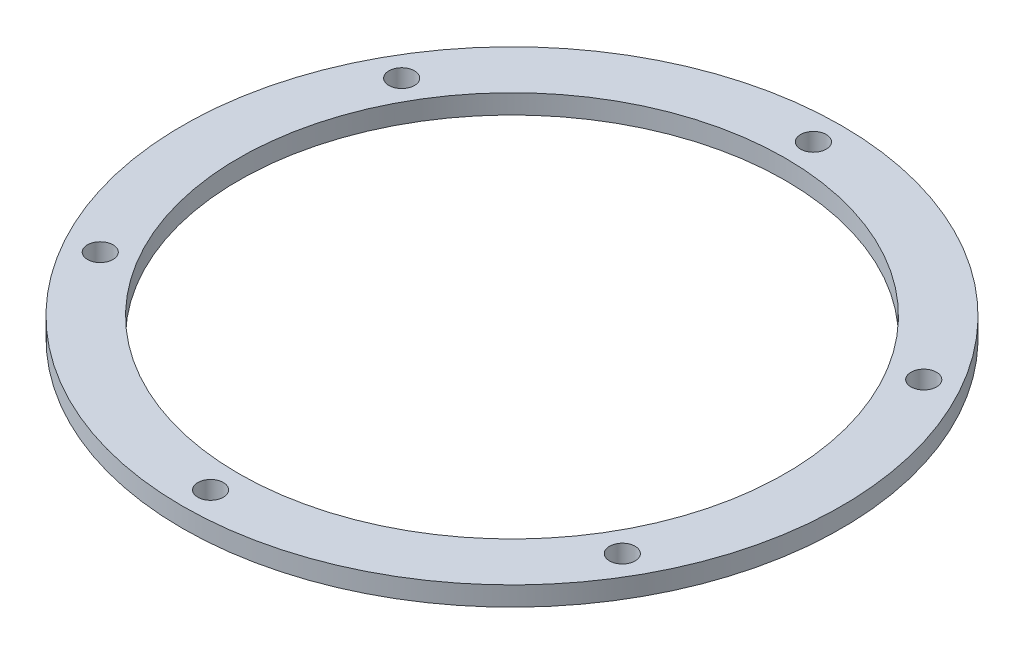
SolidWorks part; units mm, degrees
ref_plane "Front Plane" through (0, 0, 0) normal (0, 0, 1) x (1, 0, 0)
ref_plane "Top Plane" through (0, 0, 0) normal (0, 1, 0) x (1, 0, 0)
ref_plane "Right Plane" through (0, 0, 0) normal (1, 0, 0) x (0, 0, -1)
sketch "Sketch13" plane through (0, 0, 0) normal (0, 1, 0) x (1, 0, 0)
  circle A0 centre (0, 0) radius 52.07
  circle A1 centre (0, 0) radius 43.18
  circle A2 centre (0, 0) radius 47.625 construction
  dimension "D1" = 95.25
  dimension "D3" = 104.14
  dimension "D4" = 86.36
extrude "Ring" add sketch "Sketch13" along normal blind 3.048
sketch "Sketch15" plane through (0, 3.048, 0) normal (0, 1, 0) x (1, 0, 0)
  circle A0 centre (0, 47.625) radius 2.0193
  circle A1 centre (0, 0) radius 47.625 construction
  dimension "D1" = 4.0386
extrude "Holes" cut sketch "Sketch15" against normal through all both and the other way through all
pattern_circular "CirPattern1" count 6 every 60 about axis through (0, 0, 0) along (0, 1, 0) of "Holes"
